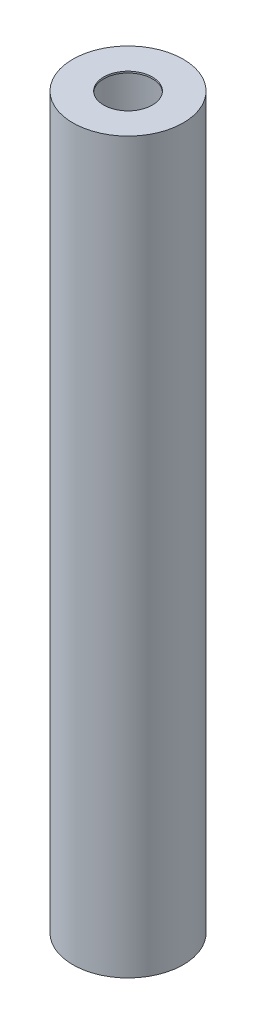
SolidWorks part; units mm, degrees
ref_plane "Front Plane" through (0, 0, 0) normal (0, 0, 1) x (1, 0, 0)
ref_plane "Top Plane" through (0, 0, 0) normal (0, 1, 0) x (1, 0, 0)
ref_plane "Right Plane" through (0, 0, 0) normal (1, 0, 0) x (0, 0, -1)
sketch "Sketch2" plane through (0, 0, 0) normal (0, 0, 1) x (1, 0, 0)
  line L0 (-7.62, 0.508) -> (-16.764, 0.508)
  line L1 (-16.764, 0.508) -> (-16.764, 227.584)
  line L2 (-16.764, 227.584) -> (-7.62, 227.584)
  line L3 (-7.62, 227.584) -> (-7.62, 228.092)
  line L4 (-7.62, 228.092) -> (-17.272, 228.092)
  line L5 (-17.272, 228.092) -> (-17.272, 0)
  line L6 (-17.272, 0) -> (-7.62, 0)
  line L7 (-7.62, 0) -> (-7.62, 0.508)
  line L8 (0, 0) -> (0, 47.5224) construction
  dimension "D1" = 34.544
  dimension "D2" = 0.508
  dimension "D3" = 0.508
  dimension "D4" = 0.508
  dimension "D5" = 228.092
  dimension "D6" = 15.24
revolve "Revolve1" add sketch "Sketch2" angle 360 about L8
